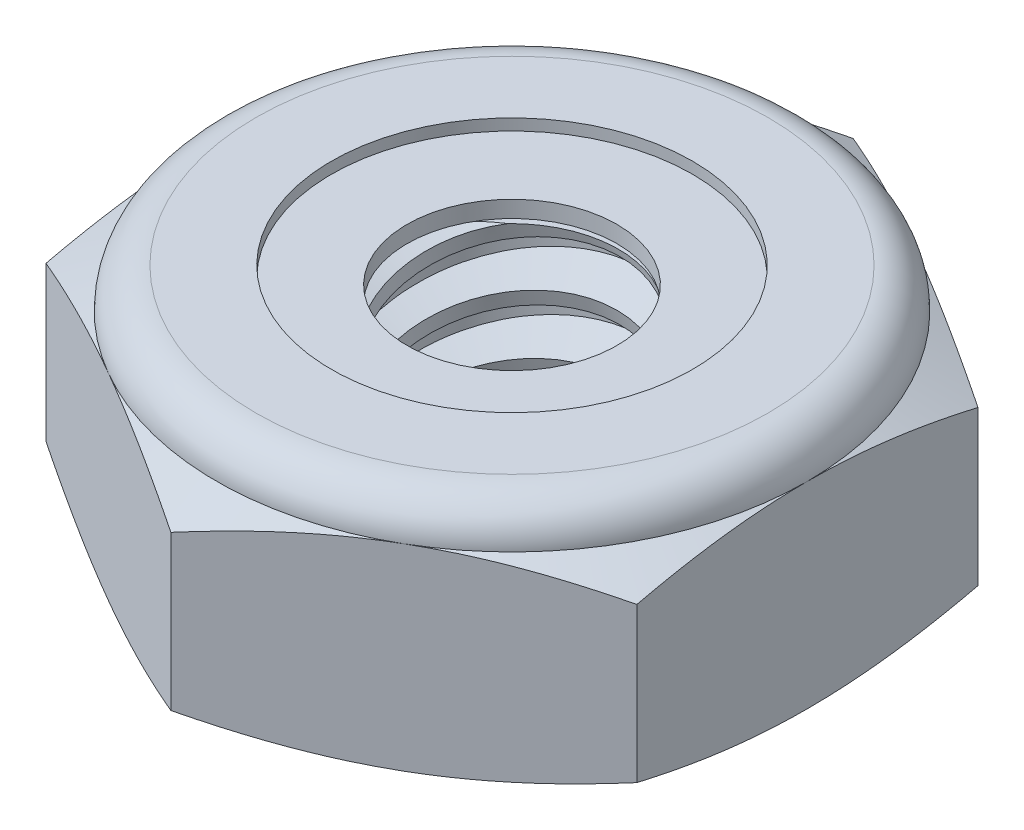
SolidWorks part; units mm, degrees
ref_plane "Front" through (0, 0, 0) normal (0, 0, 1) x (1, 0, 0)
ref_plane "Top" through (0, 0, 0) normal (0, 1, 0) x (1, 0, 0)
ref_plane "Right" through (0, 0, 0) normal (1, 0, 0) x (0, 0, -1)
sketch "Sketch1" plane through (0, 0, 0) normal (0, 1, 0) x (1, 0, 0)
  line L1 (0, 4.5827) -> (-3.9688, 2.2914)
  line L2 (-3.9688, 2.2914) -> (-3.9688, -2.2914)
  line L3 (-3.9688, -2.2914) -> (0, -4.5827)
  line L4 (0, -4.5827) -> (3.9687, -2.2914)
  line L5 (3.9687, -2.2914) -> (3.9687, 2.2914)
  line L6 (3.9687, 2.2914) -> (0, 4.5827)
  circle A0 centre (0, 0) radius 3.9688 construction
  dimension "Hex Flats" = 7.9375
extrude "Extrude1" add sketch "Sketch1" along normal blind 3.175
sketch "Sketch2" plane through (0, 0, 0) normal (1, 0, 0) x (0, 0, -1)
  line L0 (-1.7526, 0) -> (-1.7526, 3.175) construction
  line L1 (0, 0) -> (1.7526, 0)
  line L2 (0, 0) -> (0, 3.175)
  line L3 (0, 3.175) -> (1.7526, 3.175)
  line L4 (1.7526, 0) -> (1.7526, 3.175)
  line L5 (-2.2914, 3.175) -> (2.2914, 3.175) construction
  line L7 (0, -1.7526) -> (0, 0) construction
  dimension "Thread Dia" = 3.5052
revolve "Revolve1" add sketch "Sketch2" angle 360 about L7
sketch "Sketch3" plane through (0, 0, 0) normal (1, 0, 0) x (0, 0, -1)
  line L0 (1.7526, 3.175) -> (-1.7526, 3.175) construction
  line L1 (-1.7526, 3.175) -> (-1.7526, 2.3812) construction
  line L2 (-1.7526, 2.3812) -> (1.7526, 3.175) construction
  line L3 (1.7526, 3.175) -> (1.7745, 3.0782) construction
  line L4 (1.7745, 3.0782) -> (1.9279, 2.4009)
  line L5 (1.9279, 2.4009) -> (1.4541, 2.5479)
  line L6 (1.4541, 2.5479) -> (1.4103, 2.7414)
  line L7 (1.4103, 2.7414) -> (1.7745, 3.0782)
  line L8 (1.4322, 2.6447) -> (1.8512, 2.7395) construction
  line L9 (1.7526, 3.175) -> (1.7526, 2.7172) construction
  line L10 (1.7526, 2.7172) -> (-1.7526, 1.9235) construction
  line L11 (-1.7526, 1.9235) -> (-1.7526, 2.3812) construction
  line L12 (-0.1935, 3.175) -> (0.1935, 1.4657) construction
  line L13 (-1.7526, 0) -> (-1.7526, 3.175) construction
  line L14 (0, 3.175) -> (1.7526, 3.175) construction
  line L15 (1.7526, 0) -> (1.7526, 3.175) construction
  point P13 (0, 2.3203)
revolve "Cut-Revolve1" cut sketch "Sketch3" angle 360 about L12
pattern_linear "LPattern1" count 4 spacing 0.7937 along (0, -1, 0) count 2 spacing 0.7937 along (0, 1, 0) of "Cut-Revolve1"
sketch "Sketch4" plane through (0, 0, 0) normal (1, 0, 0) x (0, 0, -1)
  line L0 (0, 3.175) -> (1.7526, 3.175)
  line L1 (1.7526, 3.175) -> (1.4103, 3.0154)
  line L2 (1.4103, 3.0154) -> (1.4103, 0.1596)
  line L3 (1.4103, 0.1596) -> (1.7526, 0)
  line L4 (1.7526, 0) -> (0, 0)
  line L5 (0, 0) -> (0, 3.175)
  line L6 (1.7526, 0) -> (1.7526, 3.175) construction
  line L7 (0, 3.175) -> (1.7526, 3.175) construction
  line L8 (0, 0) -> (1.7526, 0) construction
  line L9 (0, 0) -> (0, 3.175) construction
  line L10 (0, 3.175) -> (0, 3.5527) construction
  dimension "D1" = 25
revolve "Cut-Revolve2" cut sketch "Sketch4" angle 360 about L10
combine bodies "Combine1" operation type subtract main body 112 bodies to subtract 111
sketch "Sketch5" plane through (0, 0, 0) normal (1, 0, 0) x (0, 0, -1)
  line L0 (0, 0) -> (3.9688, 0)
  line L1 (3.9688, 0) -> (4.5827, 0.2863)
  line L2 (4.5827, 0.2863) -> (4.5827, 2.3595)
  line L3 (4.5827, 2.3595) -> (3.9688, 2.6458)
  line L4 (3.4396, 3.175) -> (3.4396, 4.445)
  line L5 (3.4396, 4.445) -> (5.8527, 4.445)
  line L6 (5.8527, 4.445) -> (5.8527, -1.27)
  line L7 (5.8527, -1.27) -> (0, -1.27)
  line L8 (0, -1.27) -> (0, 0)
  line L9 (3.9688, 2.6458) -> (3.9688, 0) construction
  line L10 (0, 0) -> (1.7526, 0) construction
  line L13 (4.5827, 1.3229) -> (5.8527, 1.3229) construction
  line L14 (4.5827, 3.175) -> (4.5827, 0) construction
  line L15 (0, 0) -> (0, 4.445) construction
  line L20 (0, 4.445) -> (3.4396, 4.445) construction
  line L22 (0, 3.175) -> (1.7526, 3.175) construction
  arc A0 (3.9688, 2.6458) -> (3.4396, 3.175) centre (3.4396, 2.6458) ccw
revolve "Cut-Revolve3" cut sketch "Sketch5" angle 360 about L15
sketch "Sketch6" plane through (0, 0, 0) normal (1, 0, 0) x (0, 0, -1)
  line L0 (0, 2.6458) -> (3.8163, 2.6458)
  line L1 (3.4396, 3.0226) -> (2.4249, 3.0226)
  line L2 (0, 4.445) -> (0, 2.6458)
  line L3 (2.4249, 4.445) -> (0, 4.445)
  line L4 (0, 4.445) -> (3.4396, 4.445) construction
  line L5 (0, 0) -> (0, 4.445) construction
  line L6 (0, 4.445) -> (0, 44.323) construction
  line L7 (2.4249, 3.0226) -> (2.4249, 4.445)
  line L8 (3.4396, 3.175) -> (3.4396, 3.0226) construction
  line L9 (2.4249, 3.0226) -> (1.4103, 3.0226) construction
  line L10 (1.4103, 3.0226) -> (1.4103, 3.0154) construction
  arc A0 (3.8163, 2.6458) -> (3.4396, 3.0226) centre (3.4396, 2.6458) ccw
  arc A1 (3.9688, 2.6458) -> (3.4396, 3.175) centre (3.4396, 2.6458) ccw construction
  dimension "D1" = 0.1524
revolve "Cut-Revolve4" cut sketch "Sketch6" angle 360 about L6
sketch "Sketch7" plane through (0, 0, 0) normal (1, 0, 0) x (0, 0, -1)
  line L0 (1.4103, 2.722) -> (3.7303, 2.722)
  line L1 (3.4396, 2.9464) -> (1.4103, 2.9464)
  line L2 (1.4103, 2.9464) -> (1.4103, 2.722)
  line L3 (1.4103, 2.722) -> (0, 2.722) construction
  line L4 (0, 2.722) -> (0, 2.9464) construction
  line L5 (0, 2.9464) -> (1.4103, 2.9464) construction
  line L6 (1.4103, 2.722) -> (1.4103, 2.6458) construction
  line L7 (0, 2.6458) -> (3.8163, 2.6458) construction
  line L8 (3.4396, 2.9464) -> (3.4396, 3.0226) construction
  arc A0 (3.7303, 2.722) -> (3.4396, 2.9464) centre (3.4396, 2.6458) ccw
  arc A2 (3.8163, 2.6458) -> (3.4396, 3.0226) centre (3.4396, 2.6458) ccw construction
  dimension "D1" = 0.0762
revolve "Revolve2" add sketch "Sketch7" angle 360 about L4
equation "\"D1@Sketch3\"=\"Thread Pitch@Sketch3\"/8"
equation "\"D2@Sketch3\"=\"Thread Pitch@Sketch3\"/4"
equation "\"D5@Sketch3\"=\"Thread Pitch@Sketch3\""
equation "\"D4@LPattern1\"=\"Thread Pitch@Sketch3\""
equation "\"D3@LPattern1\"=\"Thread Pitch@Sketch3\""
equation "\"D1@LPattern1\"=\"Height@Extrude1\"/\"Thread Pitch@Sketch3\""
equation "\"D4@Sketch5\"=\"Height@Extrude1\"/6"
